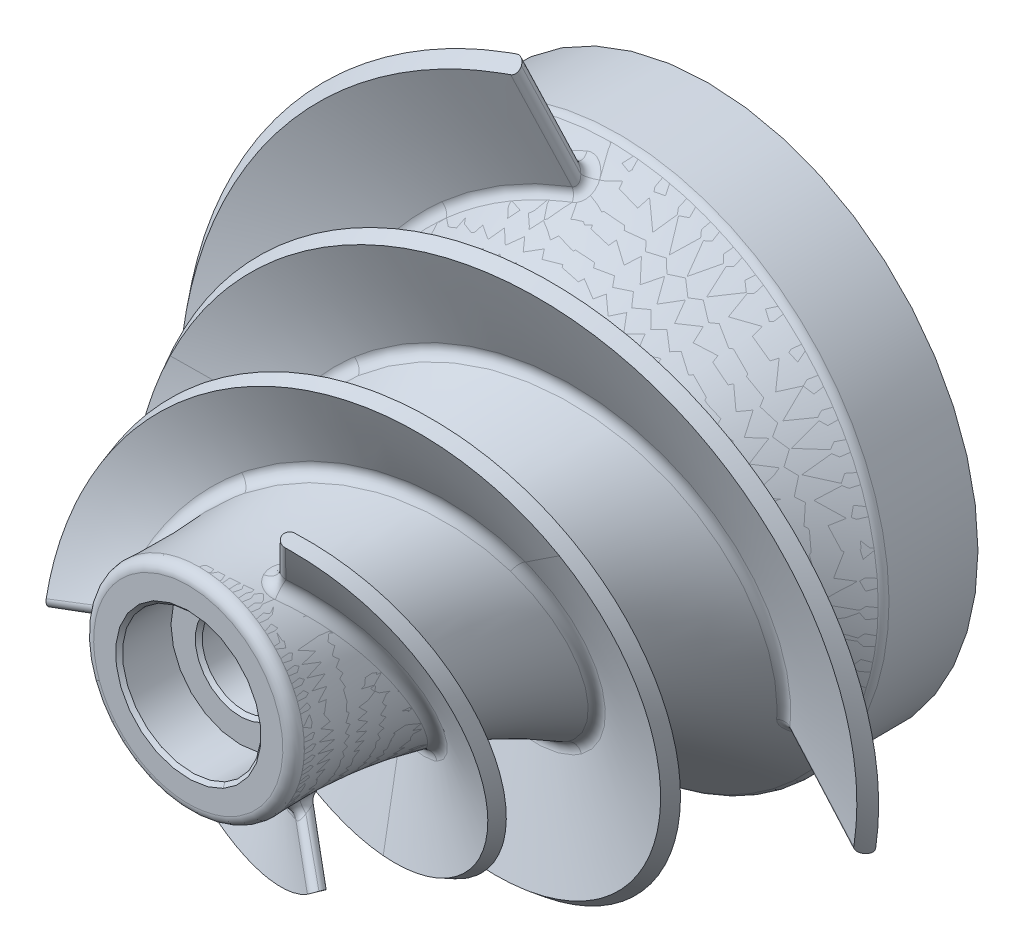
SolidWorks part; units mm, degrees
other "Corps principal"
ref_plane "Front Plane" through (0, 0, 0) normal (0, 0, 1) x (1, 0, 0)
ref_plane "Top Plane" through (0, 0, 0) normal (0, 1, 0) x (1, 0, 0)
ref_plane "Right Plane" through (0, 0, 0) normal (1, 0, 0) x (0, 0, -1)
imported_body "Imported1"
surface "Surface-Offset1" parameters "D1"=0
sketch "Sketch1" plane through (0, 0, 0) normal (0, 0, 1) x (1, 0, 0)
  line L0 (2.1796, 71.4452) -> (-2.7906, 82.9475)
  line L1 (66.293, -33.4006) -> (58.6148, -63.172)
  spline S0 degree 3 number of poles 88 (-21.6401, 39.612) -> (66.293, -33.4006) construction
  spline S2 degree 3 poles (2.1796, 71.4452) (2.2204, 71.3507) (2.3017, 71.1627) (2.389, 70.877) (2.4647, 70.5239) (2.4989, 70.1056) (2.4552, 69.633) (2.3341, 69.1835) (2.1479, 68.7822) (1.9122, 68.4275) (1.5883, 68.0577) (1.1296, 67.6732) (0.6575, 67.4015) (0.3232, 67.2487) (0.1588, 67.1801) (-0.0092, 67.1166) (-0.181, 67.0579) (-0.3564, 67.0042) (-0.5354, 66.955) (-0.6574, 66.9263) (-0.7186, 66.912) knots 0 0 0 0 0.052273 0.104018 0.155461 0.243161 0.329108 0.411996 0.49279 0.560398 0.626998 0.731037 0.833258 0.857309 0.881199 0.904978 0.928696 0.952405 0.976156 1 1 1 1 construction
surface "Surface-Extrude1" sketch "Sketch1" parameters "D1"=18
sketch "Sketch2" plane through (0, 0, 0) normal (1, 0, 0) x (0, 0, -1)
  line L0 (-104.79, 26.05) -> (-117.2406, 35.5116)
  line L1 (-102.6317, -22.3473) -> (-121.6891, -27.9373)
  spline S0 degree 3 poles (-64.6012, -30.4718) (-64.8005, -30.2379) (-65.1964, -29.7731) (-65.7904, -29.0442) (-66.3796, -28.2996) (-66.9643, -27.5384) (-67.5443, -26.7628) (-68.1197, -25.9743) (-68.6903, -25.1743) (-69.2563, -24.3643) (-69.8176, -23.5455) (-70.3741, -22.7195) (-70.9259, -21.8874) (-71.4729, -21.0504) (-72.0151, -20.2097) (-72.5524, -19.3665) (-73.0849, -18.5218) (-73.6126, -17.6766) (-74.7976, -15.7619) (-76.6337, -12.7286) (-79.1228, -8.5396) (-81.5679, -4.4161) (-84.0468, -0.2857) (-86.5675, 3.8061) (-89.1365, 7.8058) (-91.6769, 11.5459) (-93.5058, 14.0559) (-94.6207, 15.5122) (-95.032, 16.0417) (-95.443, 16.5629) (-95.8536, 17.0757) (-96.2638, 17.5799) (-96.6736, 18.0754) (-97.0831, 18.5623) (-97.4922, 19.0403) (-97.901, 19.5094) (-98.3094, 19.9695) (-98.7174, 20.4205) (-99.125, 20.8623) (-99.5322, 21.2949) (-99.939, 21.7182) (-100.3455, 22.1322) (-100.7515, 22.5367) (-101.1572, 22.9317) (-101.5625, 23.3171) (-101.9673, 23.693) (-102.3718, 24.0591) (-102.7758, 24.4157) (-103.1794, 24.7624) (-103.5826, 25.0994) (-103.9854, 25.4265) (-104.3878, 25.7444) (-104.656, 25.9482) (-104.79, 26.05) knots 0 0 0 0 0.016844 0.033476 0.0499 0.066117 0.082131 0.097942 0.113555 0.12897 0.14419 0.159217 0.174053 0.1887 0.20316 0.217435 0.231527 0.245436 0.259166 0.324901 0.388448 0.449916 0.509403 0.572904 0.63493 0.695568 0.754894 0.764575 0.774234 0.78387 0.793484 0.803077 0.812648 0.822199 0.831728 0.841237 0.850726 0.860195 0.869644 0.879074 0.888484 0.897875 0.907248 0.916603 0.925939 0.935257 0.944557 0.95384 0.963106 0.972354 0.981586 0.990801 1 1 1 1 construction
  spline S1 degree 3 poles (-102.6317, -22.3473) (-102.5189, -22.3142) (-102.2929, -22.2479) (-101.9423, -22.1656) (-101.4062, -22.0618) (-100.6717, -21.9736) (-99.7694, -21.9591) (-98.9043, -22.0288) (-98.1955, -22.1567) (-97.6187, -22.3092) (-97.0961, -22.4844) (-96.5454, -22.7207) (-96.1183, -22.9612) (-95.8453, -23.1433) (-95.6952, -23.2522) (-95.554, -23.364) (-95.4208, -23.4783) (-95.3394, -23.5568) (-95.2987, -23.596) knots 0 0 0 0 0.045067 0.090334 0.13596 0.249536 0.362951 0.46586 0.567339 0.629333 0.690576 0.778631 0.865174 0.892465 0.919534 0.94644 0.973241 1 1 1 1 construction
surface "Surface-Extrude2" sketch "Sketch2" parameters "D1"=36
surface "Surface-Trim1"
sketch "Sketch3" plane through (0, 0, 0) normal (0, 1, 0) x (1, 0, 0)
  line L0 (104.1109, -10.5) -> (76.3356, -0.5967)
  line L1 (78, 9.3012) -> (78, 15)
  line L2 (48.2302, -108.1543) -> (30.1133, -108.1543)
  line L3 (21, -115) -> (20, -114)
  line L4 (21, -115) -> (27.3142, -115)
  line L5 (78, 15) -> (13, 15)
  line L7 (21, -115) -> (20, -114)
  line L8 (12, 14) -> (13, 15)
  line L9 (-20, -100) -> (-20, -114)
  line L10 (20, -114) -> (20, -100)
  line L11 (20, -114) -> (20, -100)
  line L12 (-13, 15) -> (-12, 14)
  line L13 (-20, -100) -> (-13, -100)
  line L14 (13, -100) -> (20, -100)
  line L15 (13, -100) -> (20, -100)
  line L16 (0, 0) -> (0, -140.2602) construction
  line L17 (13, -100) -> (12, -99)
  line L18 (13, -100) -> (12, -99)
  line L19 (-12, 14) -> (-12, -99)
  line L20 (12, -99) -> (12, 14)
  line L21 (12, -99) -> (12, 14)
  line L22 (12, 14) -> (13, 15)
  arc A1 (104.1109, -10.5) -> (48.2302, -108.1543) centre (235.4583, -150.4763) ccw
  arc A3 (77.0586, 7.119) -> (75.0628, 5.2012) centre (179.9867, -101.9947) ccw
  arc A5 (77.0586, 7.119) -> (78, 9.3012) centre (75, 9.3012) ccw
  arc A7 (30.1133, -108.1543) -> (30.3078, -111.8038) centre (179.9867, -101.9947) ccw
  arc A9 (27.3142, -115) -> (30.3078, -111.8038) centre (27.3142, -112) ccw
  arc A11 (76.3356, -0.5967) -> (75.0628, 5.2012) centre (77.511, 2.7) cw
  dimension "D1" = 3.5
  dimension "D2" = 25.5
  dimension "D3" = 12.3
revolve "Revolve1" [suppressed] add sketch "Sketch3" angle 360 about L16
other "DeleteFace5" [suppressed]
other "Move Face1" parameters "D1"=20
